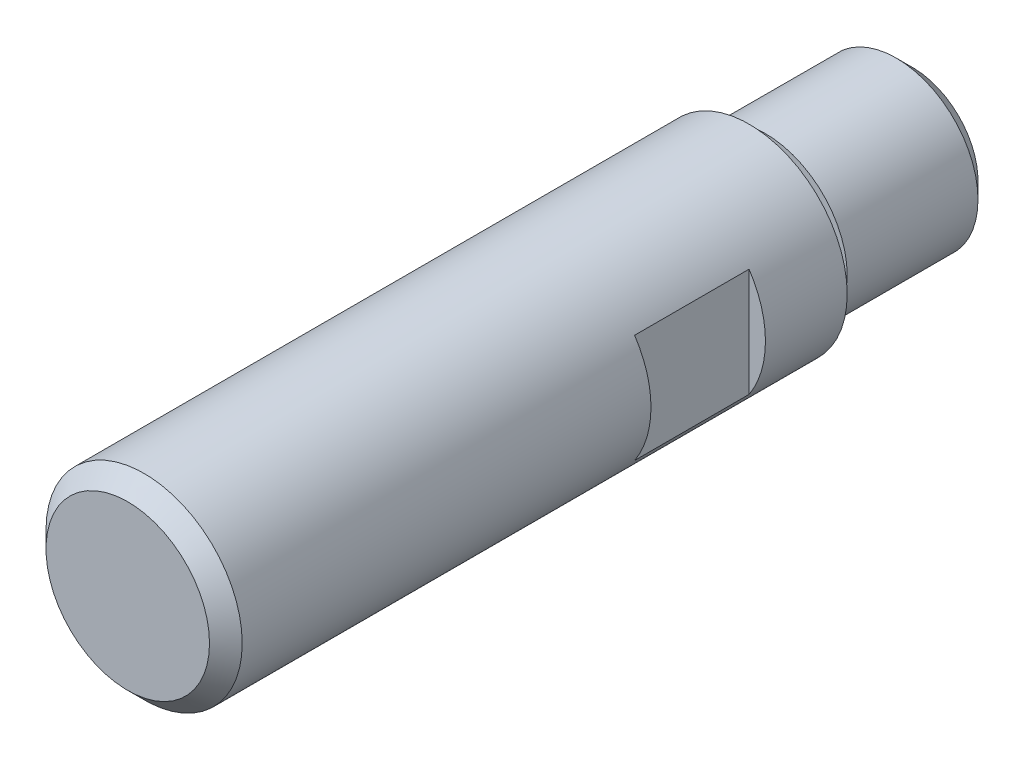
SolidWorks part; units mm, degrees
ref_plane "Face" through (0, 0, 0) normal (0, 0, 1) x (1, 0, 0)
ref_plane "Dessus" through (0, 0, 0) normal (0, 1, 0) x (1, 0, 0)
ref_plane "Droite" through (0, 0, 0) normal (1, 0, 0) x (0, 0, -1)
sketch "Esquisse1" plane through (0, 0, 0) normal (0, 0, 1) x (1, 0, 0)
  circle A0 centre (0, 0) radius 6
extrude "Base-Extrusion" add sketch "Esquisse1" against normal blind 38
chamfer "Chanfrein1" distance 1 angle 45 1 edges at (6, 0, 0)
sketch "Esquisse3" plane through (0, 0, -38) normal (0, 0, -1) x (-1, 0, 0)
  circle A0 centre (0, 0) radius 5
extrude "Boss.-Extru.1" add sketch "Esquisse3" against normal blind 10
sketch "Esquisse4" plane through (0, 0, -38) normal (0, 0, -1) x (-1, 0, 0)
  circle A0 centre (0, 0) radius 5
extrude "Boss.-Extru.2" add sketch "Esquisse4" along normal blind 10
chamfer "Chanfrein2" distance 1 angle 45 1 edges at (-5, 0, -48)
sketch "Esquisse5" plane through (0, 0, 0) normal (0, 1, 0) x (1, 0, 0)
  line L0 (6, 38) -> (-6, 38) construction
  line L1 (-5.0299, 38) -> (-4.2799, 38)
  line L2 (-5.0299, 38) -> (-5.0299, 39)
  line L3 (-5.0299, 39) -> (-4.2799, 39)
  line L4 (-4.2799, 38) -> (-4.2799, 39)
  line L5 (0, 0) -> (0, 48.823) construction
  line L6 (0, 38) -> (0, 1) construction
  dimension "D1" = 0.75
  dimension "D2" = 1
revolve "Enlèvement de matière-Révolution2" cut sketch "Esquisse5" angle 360 about L5
sketch "Esquisse7" plane through (0, 0, 0) normal (0, 1, 0) x (1, 0, 0)
  line L0 (6, 38) -> (-6, 38) construction
  line L1 (12.2582, 33) -> (5, 33)
  line L2 (12.2582, 33) -> (12.2582, 26)
  line L3 (12.2582, 26) -> (5, 26)
  line L4 (5, 33) -> (5, 26)
  line L5 (-20.8873, 33) -> (-5, 33)
  line L6 (-20.8873, 33) -> (-20.8873, 26)
  line L7 (-20.8873, 26) -> (-5, 26)
  line L8 (-5, 33) -> (-5, 26)
  dimension "D1" = 7
  dimension "D2" = 7
  dimension "D3" = 10
  dimension "D4" = 5
  dimension "D5" = 5
  dimension "D6" = 5
extrude "Enlèv. mat.-Extru.1" cut sketch "Esquisse7" against normal mid plane 18
thread "Filetage1" pitch 1.5 start angle 0, offset 5, length 0, pitch 1.5, diameter 10
ref_plane "Plan1" through (5, 0, -52) normal (0, -1, 0) x (1, 0, 0)
sketch "Profil de filetage1" plane through (5, 0, -52) normal (0, -1, 0) x (1, 0, 0)
  line L0 (0, 0) -> (0, 1.5) construction
  line L11 (0, 0) -> (0, 1.3125)
  line L12 (0, 1.3125) -> (-0.8119, 0.8437)
  line L13 (-0.8119, 0.8437) -> (-0.8119, 0.4687)
  line L15 (-0.8119, 0.4687) -> (0, 0)
  line L17 (-0.8119, 0.6562) -> (0, 0.6562) construction
  point P2 (0, 0)
  dimension "Pitch" = 1.5
  dimension "Profile_Angle" = 60
  dimension "Profile_Land" = 0.375
  dimension "Profile_Height" = 0.8119
thread "Filetage2" pitch 1.75 start angle 0, offset 4, length 20, pitch 1.75, diameter 12
ref_plane "Plan2" through (-6, 0, 3) normal (0, -1, 0) x (-1, 0, 0)
sketch "Profil de filetage2" plane through (-6, 0, 3) normal (0, -1, 0) x (-1, 0, 0)
  line L0 (0, 0) -> (0, 1.75) construction
  line L11 (0, 0) -> (0, 1.5312)
  line L12 (0, 1.5312) -> (-0.9472, 0.9844)
  line L13 (-0.9472, 0.9844) -> (-0.9472, 0.5469)
  line L15 (-0.9472, 0.5469) -> (0, 0)
  line L17 (-0.9472, 0.7656) -> (0, 0.7656) construction
  point P2 (0, 0)
  dimension "Pitch" = 1.75
  dimension "Profile_Angle" = 60
  dimension "Profile_Land" = 0.4375
  dimension "Profile_Height" = 0.9472
